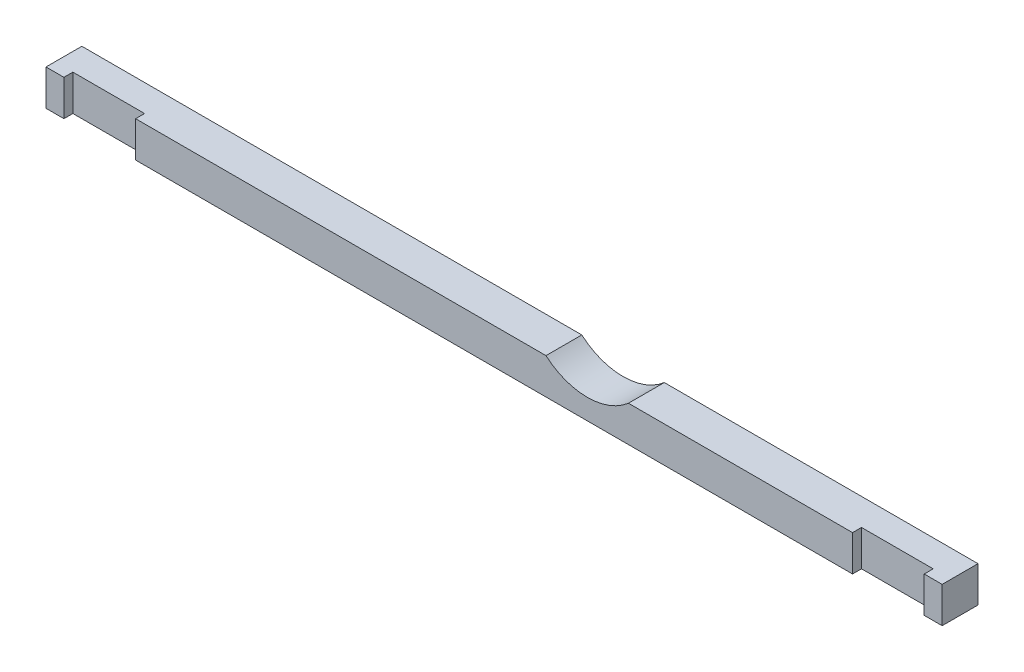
SolidWorks part; units mm, degrees
ref_plane "前视基准面" through (0, 0, 0) normal (0, 0, 1) x (1, 0, 0)
ref_plane "上视基准面" through (0, 0, 0) normal (0, 1, 0) x (1, 0, 0)
ref_plane "右视基准面" through (0, 0, 0) normal (1, 0, 0) x (0, 0, -1)
other "Configuration Table"
sketch "草图1" plane through (0, 0, 0) normal (0, 1, 0) x (1, 0, 0)
  line L0 (-125, 10) -> (125, 10)
  line L1 (0, 0) -> (0, 87.4961) construction
  line L2 (-125, 10) -> (-125, 0)
  line L3 (-125, 0) -> (-120, 0)
  line L4 (-120, 0) -> (-120, 2.5)
  line L5 (-120, 2.5) -> (-100, 2.5)
  line L6 (-100, 2.5) -> (-100, 0)
  line L7 (-100, 0) -> (100, 0)
  line L8 (125, 10) -> (125, 0)
  line L9 (0, 0) -> (19.2701, 0) construction
  line L10 (120, 0) -> (120, 2.5)
  line L11 (100, 2.5) -> (100, 0)
  line L12 (120, 2.5) -> (100, 2.5)
  line L13 (120, 0) -> (125, 0)
  dimension "D1" = 250
  dimension "D2" = 2.5
  dimension "D3" = 20
  dimension "D4" = 5
  dimension "D5" = 10
extrude "凸台-拉伸1" add sketch "草图1" along normal blind 10
sketch "草图2" plane through (0, 0, -10) normal (0, 0, -1) x (-1, 0, 0)
  circle A0 centre (-25.9808, 23.1878) radius 17.5
  dimension "D1" = 35
extrude "切除-拉伸1" cut sketch "草图2" against normal up to surface (10 mm away)
